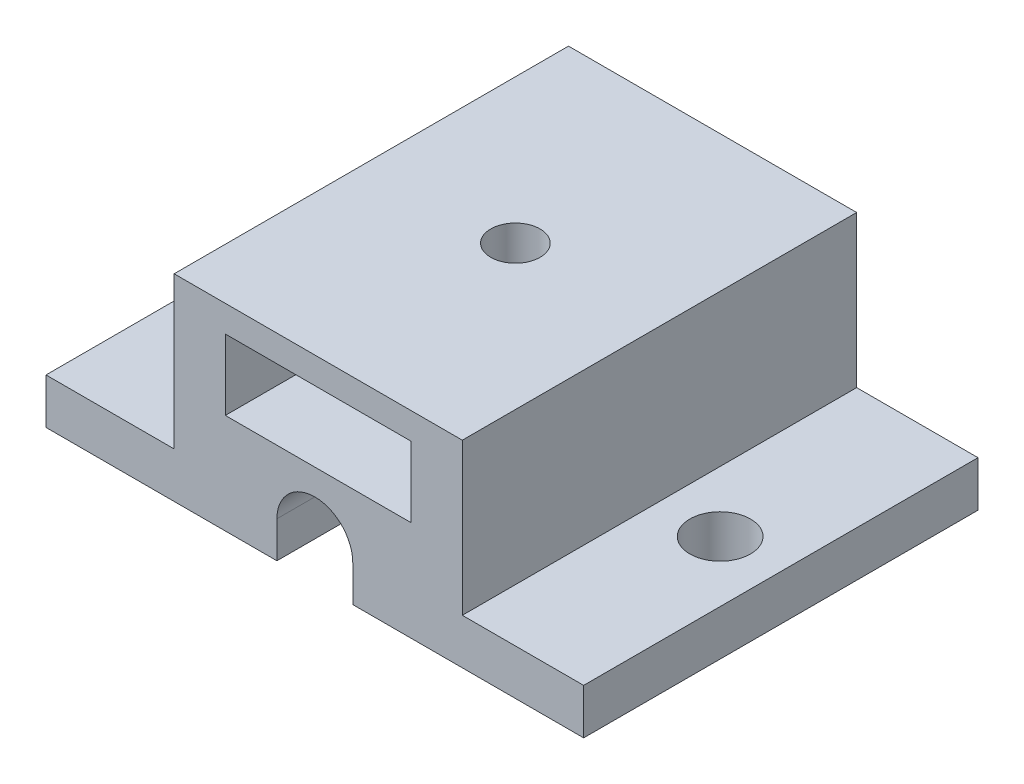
SolidWorks part; units mm, degrees
ref_plane "Front Plane" through (0, 0, 0) normal (0, 0, 1) x (1, 0, 0)
ref_plane "Top Plane" through (0, 0, 0) normal (0, 1, 0) x (1, 0, 0)
ref_plane "Right Plane" through (0, 0, 0) normal (1, 0, 0) x (0, 0, -1)
sketch "Sketch1" plane through (0, 0, 0) normal (0, 0, 1) x (1, 0, 0)
  line L5 (35.4483, 0) -> (35.4483, 3)
  line L6 (35.4483, 3) -> (27.4483, 3)
  line L7 (27.4483, 3) -> (27.4483, 13)
  line L8 (27.4483, 13) -> (8.4483, 13)
  line L9 (8.4483, 13) -> (8.4483, 3)
  line L10 (8.4483, 3) -> (0, 3)
  line L11 (0, 3) -> (0, 0)
  line L12 (35.4483, 0) -> (0, 0)
  dimension "D1" = 3
  dimension "D5" = 3
  dimension "D6" = 8
  dimension "D7" = 10
  dimension "D8" = 19
extrude "Boss-Extrude1" add sketch "Sketch1" along normal blind 26
sketch "Sketch2" plane through (0, 3, 0) normal (0, 1, 0) x (1, 0, 0)
  line L0 (0, -26) -> (0, 0) construction
  line L2 (8.4483, 0) -> (0, 0) construction
  line L3 (35.4483, 0) -> (27.4483, 0) construction
  line L4 (35.4483, -26) -> (35.4483, 0) construction
  circle A0 centre (4, -13) radius 2
  circle A1 centre (31.4483, -13) radius 2
  dimension "D2" = 4
  dimension "D4" = 4
  dimension "D5" = 13
  dimension "D6" = 4
  dimension "D1" = 4
  dimension "D3" = 13
extrude "Cut-Extrude1" cut sketch "Sketch2" against normal blind 20
sketch "Sketch4" plane through (0, 0, 0) normal (0, 0, -1) x (-1, 0, 0)
  line L0 (0, 3) -> (0, 0) construction
  line L1 (0, 0) -> (-35.4483, 0) construction
  line L2 (-20.225, 2.4) -> (-20.225, 0)
  line L3 (-15.225, 2.4) -> (-15.225, 0)
  line L4 (-20.225, 0) -> (-15.225, 0)
  arc A0 (-15.225, 2.4) -> (-20.225, 2.4) centre (-17.725, 2.4) ccw
  dimension "D1" = 5
  dimension "D2" = 17.725
  dimension "D3" = 2.4
extrude "Cut-Extrude2" cut sketch "Sketch4" against normal through all
sketch "Sketch6" plane through (0, 13, 0) normal (0, 1, 0) x (1, 0, 0)
  line L0 (27.4483, -26) -> (8.4483, -26) construction
  line L1 (27.4483, -26) -> (27.4483, 0) construction
  circle A0 centre (17.9483, -13) radius 1.625
  dimension "D1" = 3.25
  dimension "D2" = 13
  dimension "D3" = 9.5
extrude "Cut-Extrude3" cut sketch "Sketch6" against normal through all
sketch "Sketch7" plane through (0, 0, 26) normal (0, 0, 1) x (1, 0, 0)
  line L0 (8.4483, 13) -> (8.4483, 3) construction
  line L1 (11.8233, 11.25) -> (24.0733, 11.25)
  line L2 (11.8233, 11.25) -> (11.8233, 6.6)
  line L3 (11.8233, 6.6) -> (24.0733, 6.6)
  line L4 (24.0733, 11.25) -> (24.0733, 6.6)
  line L5 (27.4483, 13) -> (8.4483, 13) construction
  dimension "D1" = 12.25
  dimension "D2" = 3.375
  dimension "D3" = 1.75
  dimension "D4" = 4.65
extrude "Cut-Extrude4" cut sketch "Sketch7" against normal blind 10
